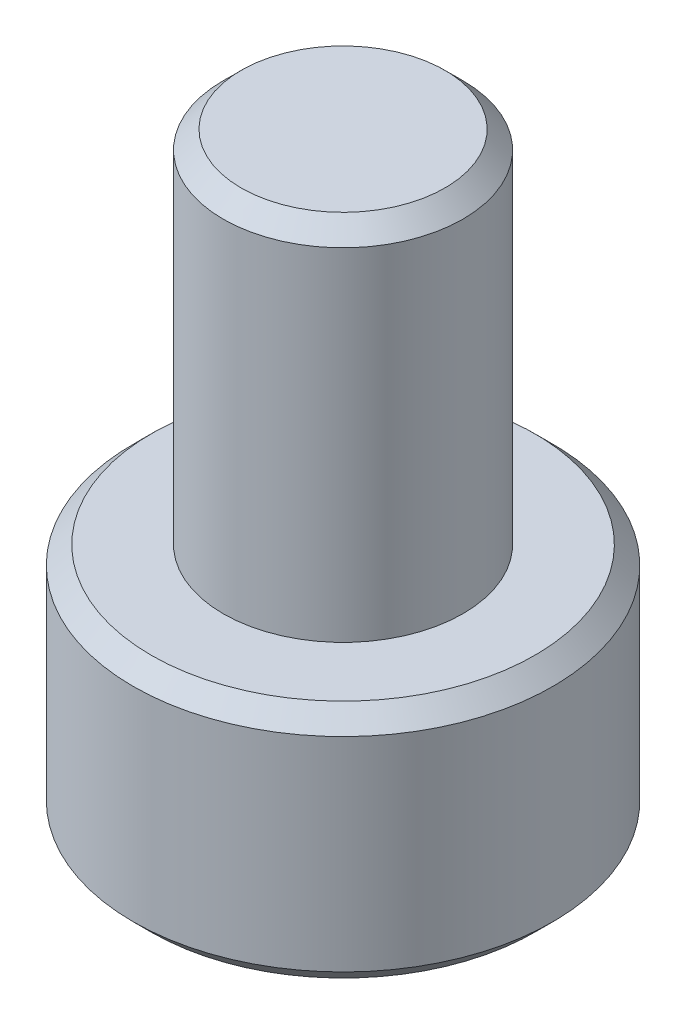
SolidWorks part; units mm, degrees
ref_plane "Front" through (0, 0, 0) normal (0, 0, 1) x (1, 0, 0)
ref_plane "Top" through (0, 0, 0) normal (0, 1, 0) x (1, 0, 0)
ref_plane "Right" through (0, 0, 0) normal (1, 0, 0) x (0, 0, -1)
sketch "Sketch1" plane through (0, 0, 0) normal (0, 1, 0) x (1, 0, 0)
  circle A0 centre (0, 0) radius 3.5
  dimension "D1" = 7
extrude "Boss-Extrude1" add sketch "Sketch1" along normal blind 4
sketch "Sketch2" plane through (0, 4, 0) normal (0, 1, 0) x (1, 0, 0)
  circle A0 centre (0, 0) radius 2
  dimension "D1" = 4
extrude "Boss-Extrude2" add sketch "Sketch2" along normal blind 6
chamfer "Chamfer1" distance 0.3 angle 45 2 edges at (0, 0, 3.5) (0, 4, 3.5)
chamfer "Chamfer2" distance 0.3 angle 45 1 edges at (0, 10, 2)
sketch "Sketch3" plane through (0, 0, 0) normal (0, -1, 0) x (1, 0, 0)
  line L1 (1.7725, 0) -> (0.8862, 1.535)
  line L2 (0.8862, 1.535) -> (-0.8862, 1.535)
  line L3 (-0.8862, 1.535) -> (-1.7725, 0)
  line L4 (-1.7725, 0) -> (-0.8862, -1.535)
  line L5 (-0.8862, -1.535) -> (0.8862, -1.535)
  line L6 (0.8862, -1.535) -> (1.7725, 0)
  circle A0 centre (0, 0) radius 1.535 construction
  dimension "D1" = 3.07
extrude "Cut-Extrude1" cut sketch "Sketch3" against normal blind 2
